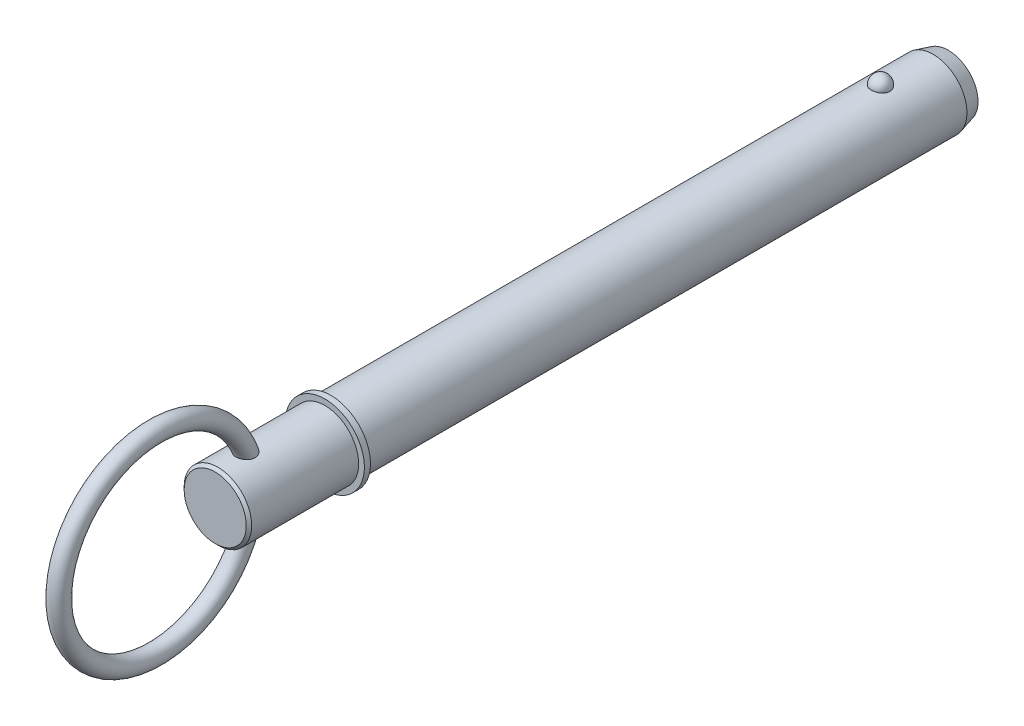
SolidWorks part; units mm, degrees
ref_plane "Front Plane" through (0, 0, 0) normal (0, 0, 1) x (1, 0, 0)
ref_plane "Top Plane" through (0, 0, 0) normal (0, 1, 0) x (1, 0, 0)
ref_plane "Right Plane" through (0, 0, 0) normal (1, 0, 0) x (0, 0, -1)
sketch "Sketch2" plane through (0, 0, 0) normal (0, 0, 1) x (1, 0, 0)
  circle A0 centre (0, 0) radius 11.115
  point P3 (0, 11.115)
  dimension "D1" = 22.23
extrude "Boss-Extrude1" add sketch "Sketch2" along normal blind 177.8
sketch "Sketch3" plane through (0, 0, 0) normal (0, 0, -1) x (-1, 0, 0)
  circle A0 centre (0, 0) radius 11.115
  dimension "D1" = 22.23
extrude "Boss-Extrude2" add sketch "Sketch3" along normal blind 25.4
chamfer "Chamfer1" distance 5 angle 15 1 edges at (-11.115, 0, -25.4)
sketch "Sketch18" plane through (0, 0, 0) normal (1, 0, 0) x (0, 0, -1)
  line L0 (20.4, 11.115) -> (-177.8, 11.115) construction
  line L1 (3.07, 14.185) -> (3.07, 8.045)
  line L2 (-177.8, -11.115) -> (20.4, -11.115) construction
  arc A0 (3.07, 14.185) -> (3.07, 8.045) centre (3.07, 11.115) ccw
  point P4 (0, 11.115)
  dimension "D1" = 25.3
revolve "Revolve1" add sketch "Sketch18" angle 360 about L1
sketch "Sketch19" plane through (0, 0, 0) normal (1, 0, 0) x (0, 0, -1)
  line L0 (-33.7288, 0) -> (-46.4542, 0) construction
sketch "Sketch20" plane through (0, 0, 0) normal (1, 0, 0) x (0, 0, -1)
  line L0 (-177.8, 0) -> (-177.8, 13)
  line L1 (-177.8, 11.115) -> (-177.8, -11.115) construction
  line L2 (-177.8, 13) -> (-179.8, 13)
  line L3 (-179.8, 13) -> (-179.8, 0)
  line L4 (-33.7288, 0) -> (-46.4542, 0) construction
  line L5 (-179.8, 0) -> (-177.8, 0)
  dimension "D1" = 13
  dimension "D2" = 2
revolve "Revolve2" add sketch "Sketch20" angle 360 about L0
sketch "Sketch21" plane through (0, 0, 177.8) normal (0, 0, -1) x (-1, 0, 0)
  circle A0 centre (0, 0) radius 11.115
  dimension "D1" = 22.23
extrude "Boss-Extrude3" add sketch "Sketch21" against normal blind 38.1
chamfer "Chamfer2" distance 0.9 angle 45 1 edges at (-11.115, 0, 215.9)
sketch "Sketch23" plane through (0, 0, 0) normal (1, 0, 0) x (0, 0, -1)
  line L0 (-215.9, 10.215) -> (-215.9, -10.215) construction
  circle A0 centre (-235.65, 0) radius 31.75
  point P2 (-203.9, 0)
  dimension "D1" = 63.5
  dimension "D2" = 12
sketch "Sketch24" plane through (0, 0, 0) normal (0, 1, 0) x (1, 0, 0)
  circle A0 centre (0, -203.9) radius 3
  dimension "D1" = 6
sweep "Sweep1" add profiles "Sketch24" path "Sketch23"
